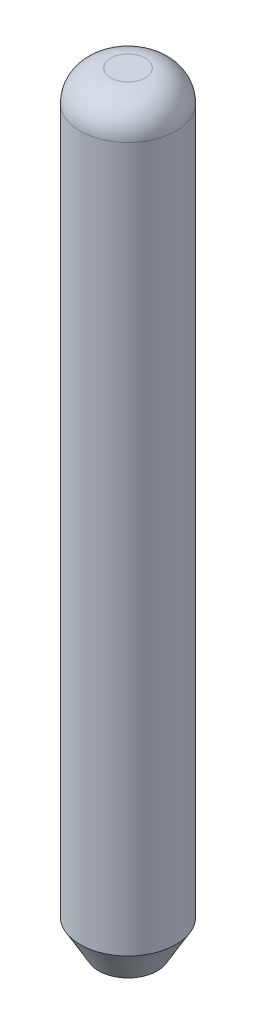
SolidWorks part; units mm, degrees
ref_plane "Front x-y" through (0, 0, 0) normal (0, 0, 1) x (1, 0, 0)
ref_plane "Top x-z" through (0, 0, 0) normal (0, 1, 0) x (1, 0, 0)
ref_plane "Side y-z" through (0, 0, 0) normal (1, 0, 0) x (0, 0, -1)
sketch "Sketch1" plane through (0, 0, 0) normal (0, 0, 1) x (1, 0, 0)
  line L0 (0, 0) -> (0, 6.35) construction
  line L1 (0, 0) -> (0, 6.35)
  line L2 (0, 6.35) -> (0.1422, 6.35)
  line L3 (0.3962, 6.096) -> (0.3962, 0.2655)
  line L4 (0.3962, 0.2655) -> (0.2429, 0)
  line L5 (0.2429, 0) -> (0, 0)
  arc A0 (0.3962, 6.096) -> (0.1422, 6.35) centre (0.1422, 6.096) ccw
  dimension "D4" = 0.3962
  dimension "D1" = 0.254
  dimension "D2" = 6.35
  dimension "D3" = 0.1533
  dimension "D5" = 30
revolve "Base-Revolve" add sketch "Sketch1" angle 360 about L0
ref_plane "Plane1" through (0, 3.175, 0) normal (0, 1, 0) x (-1, 0, 0)
